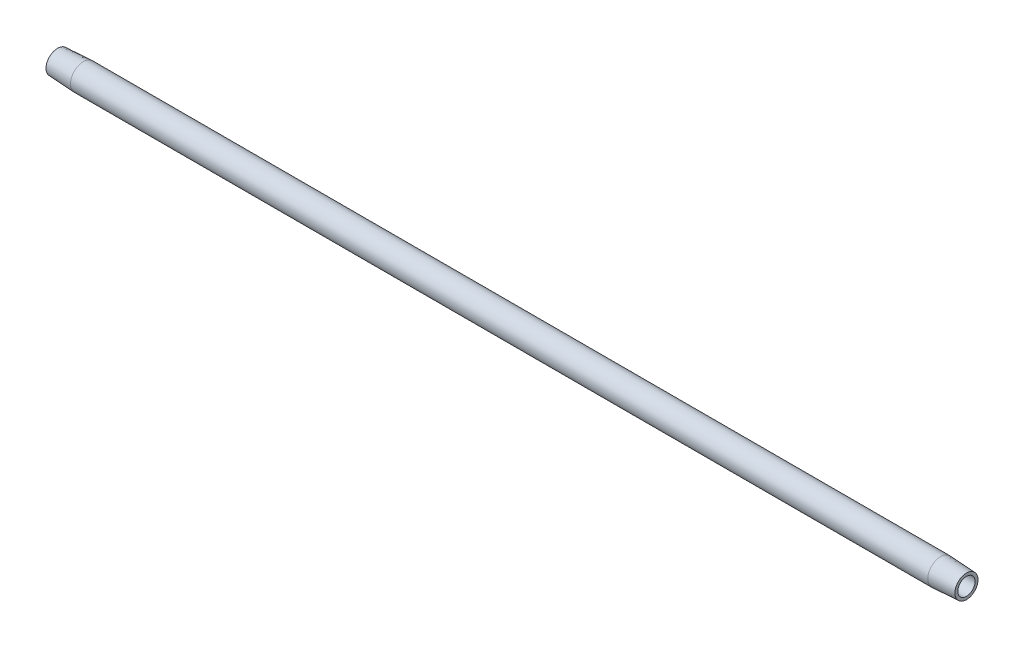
SolidWorks part; units mm, degrees
ref_plane "Front Plane" through (0, 0, 0) normal (0, 0, 1) x (1, 0, 0)
ref_plane "Top Plane" through (0, 0, 0) normal (0, 1, 0) x (1, 0, 0)
ref_plane "Right Plane" through (0, 0, 0) normal (1, 0, 0) x (0, 0, -1)
sketch "Sketch2" plane through (0, 0, 0) normal (0, 0, 1) x (1, 0, 0)
  line L0 (0.4761, 0) -> (50000.4761, 0) construction
  line L1 (0, -11.3625) -> (0, 49988.6375) construction
  line L7 (7.9375, 3.9687) -> (0, 3.5528)
  line L8 (271.4625, 3.9688) -> (7.9375, 3.9687)
  line L9 (279.4, 3.5528) -> (271.4625, 3.9688)
  line L10 (279.4, 2.6543) -> (279.4, 3.5528)
  line L11 (279.4, 2.6543) -> (0, 2.6543)
  line L12 (0, 3.5528) -> (0, 2.6543)
  dimension "D1" = 5.3086
  dimension "D2" = 7.9375
  dimension "D3" = 3
  dimension "D4" = 3
  dimension "D5" = 7.9375
  dimension "D6" = 7.9375
  dimension "D7" = 279.4
revolve "Revolve1" add sketch "Sketch2" angle 360 about L0
